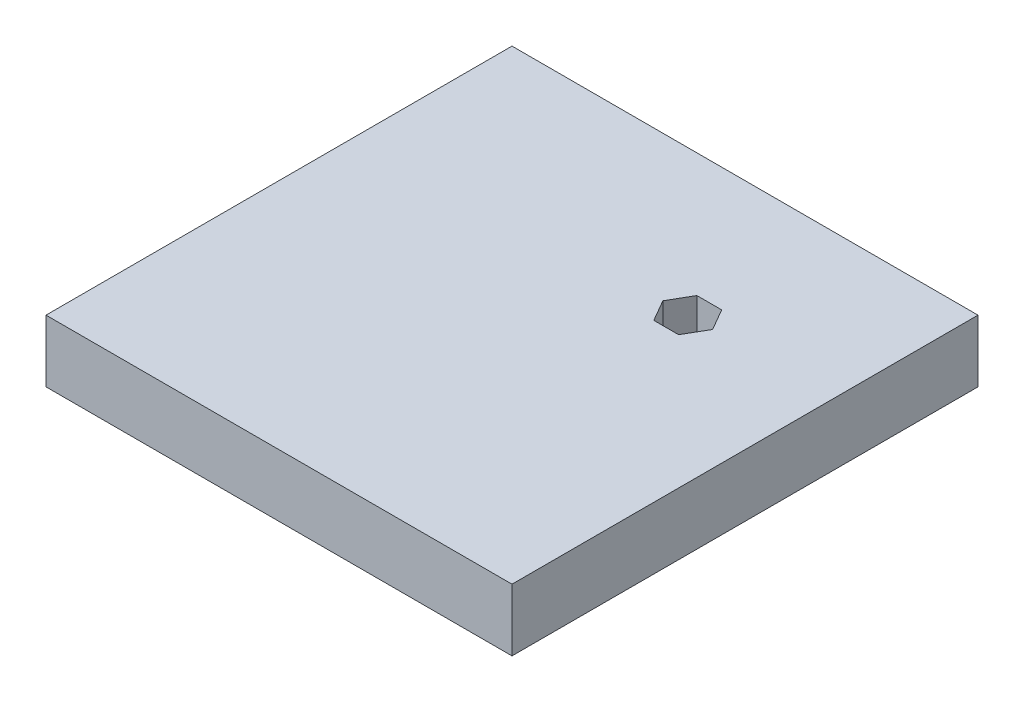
SolidWorks part; units mm, degrees
ref_plane "Front" through (0, 0, 0) normal (0, 0, 1) x (1, 0, 0)
ref_plane "Top" through (0, 0, 0) normal (0, 1, 0) x (1, 0, 0)
ref_plane "Right" through (0, 0, 0) normal (1, 0, 0) x (0, 0, -1)
sketch "Sketch2" plane through (0, 0, 0) normal (0, 1, 0) x (1, 0, 0)
  line L0 (75, -75) -> (-75, 75) construction
  line L1 (-75, 75) -> (75, 75)
  line L2 (-75, 75) -> (-75, -75)
  line L3 (-75, -75) -> (75, -75)
  line L4 (75, 75) -> (75, -75)
  dimension "D1" = 150
  dimension "D2" = 150
extrude "Extrude1" add sketch "Sketch2" along normal blind 20
sketch "Sketch3" plane through (0, 20, 0) normal (0, 1, 0) x (1, 0, 0)
  line L0 (0, 0) -> (67.7087, 0) construction
  line L1 (36.2843, 28.2843) -> (32.2843, 35.2125)
  line L2 (32.2843, 35.2125) -> (24.2843, 35.2125)
  line L3 (24.2843, 35.2125) -> (20.2843, 28.2843)
  line L4 (20.2843, 28.2843) -> (24.2843, 21.3561)
  line L5 (24.2843, 21.3561) -> (32.2843, 21.3561)
  line L6 (32.2843, 21.3561) -> (36.2843, 28.2843)
  line L7 (0, 0) -> (28.2843, 28.2843) construction
  circle A0 centre (28.2843, 28.2843) radius 6.9282 construction
  dimension "D2" = 8
  dimension "D1" = 40
  dimension "D3" = 45
extrude "Cut-Extrude1" cut sketch "Sketch3" against normal through all
